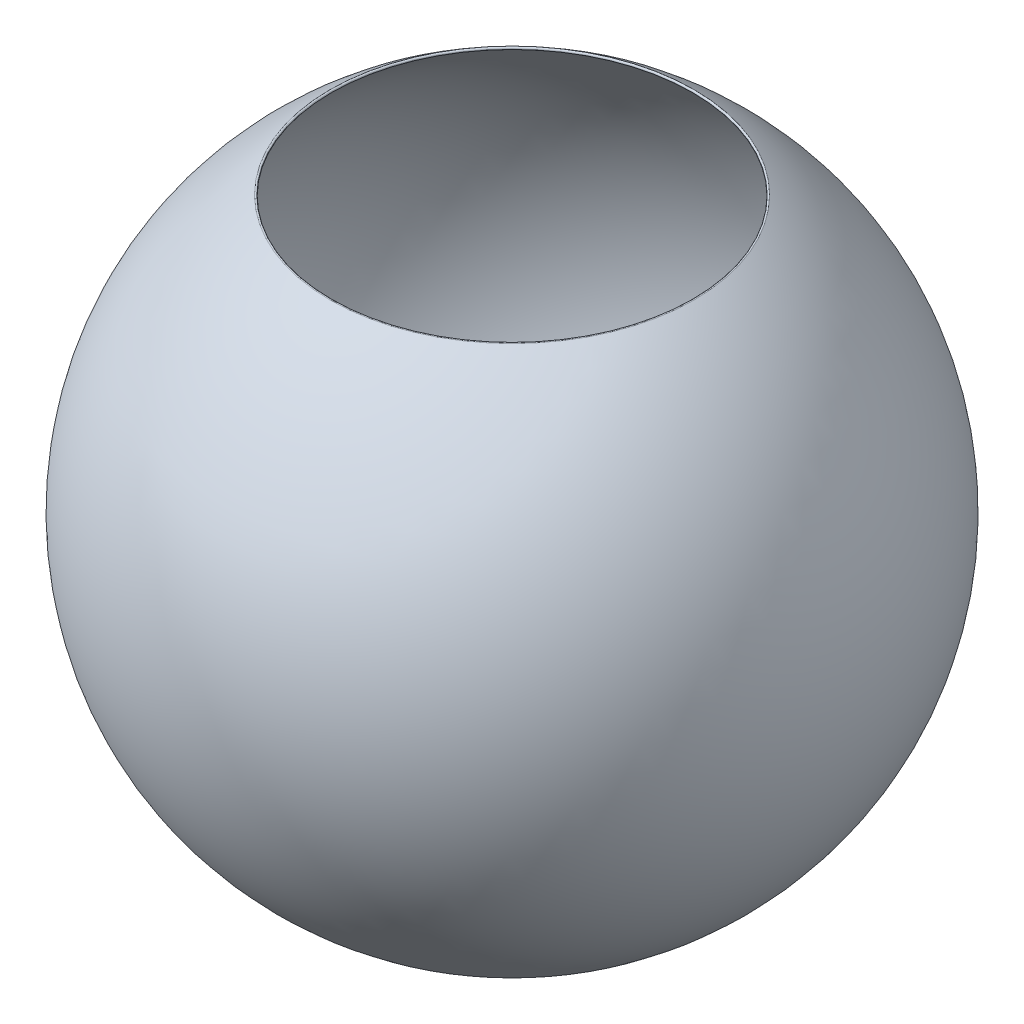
SolidWorks part; units mm, degrees
ref_plane "Ebene vorne" through (0, 0, 0) normal (0, 0, 1) x (1, 0, 0)
ref_plane "Ebene oben" through (0, 0, 0) normal (0, 1, 0) x (1, 0, 0)
ref_plane "Ebene rechts" through (0, 0, 0) normal (1, 0, 0) x (0, 0, -1)
sketch "Skizze2" plane through (0, 0, 0) normal (0, 0, 1) x (1, 0, 0)
  line L0 (0, 158.3509) -> (-105, 158.3509) construction
  line L1 (0, -190) -> (0, 158.3509) construction
  line L2 (0, -190.7) -> (0, -189.3)
  arc A0 (-105, 158.3509) -> (0, -190) centre (0, 0) ccw construction
  arc A1 (-105.3868, 158.9343) -> (0, -190.7) centre (0, 0) ccw
  arc A2 (-104.6132, 157.7675) -> (0, -189.3) centre (0, 0) ccw
  arc A3 (-105.3868, 158.9343) -> (-104.6132, 157.7675) centre (-105, 158.3509) cw
  dimension "D1" = 0.7
  dimension "D2" = 105
  dimension "D3" = 0.7
revolve "Rotation2" add sketch "Skizze2" angle 360 about L1
ref_plane "Ebene1" through (0, 10, 0) normal (0, 1, 0) x (1, 0, 0)
